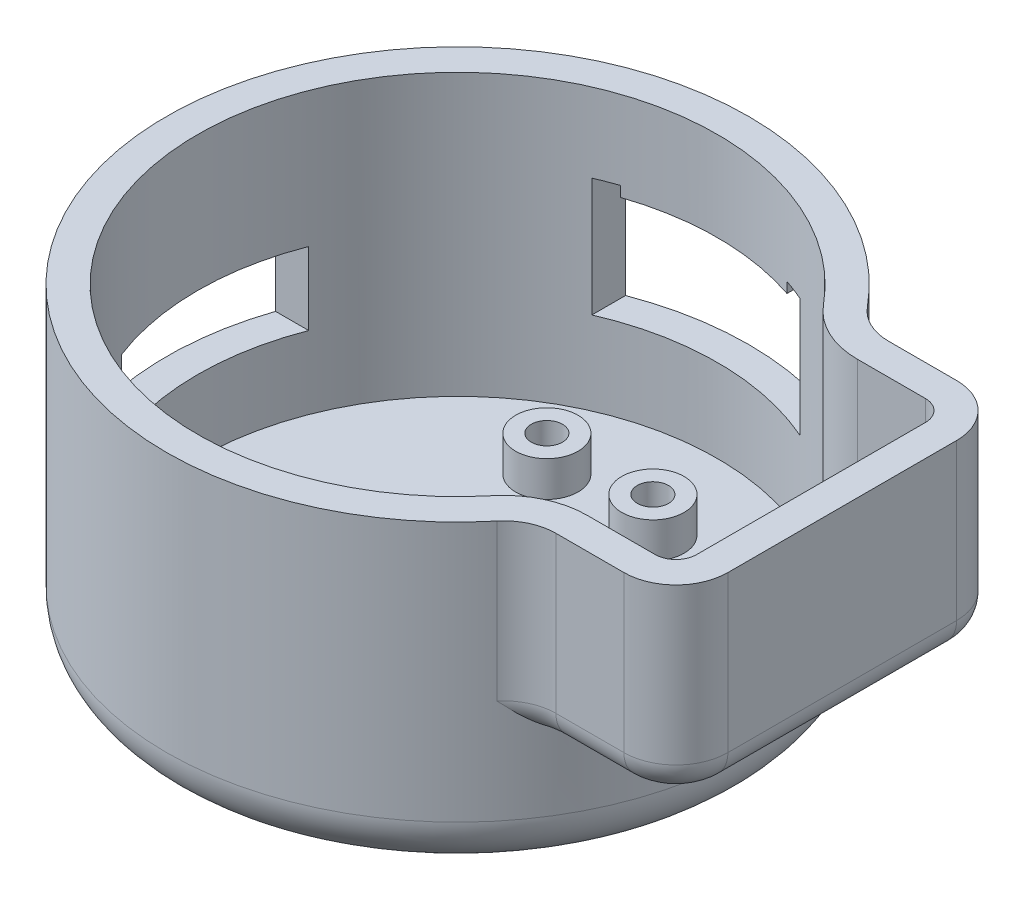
SolidWorks part; units mm, degrees
ref_plane "前视基准面" through (0, 0, 0) normal (0, 0, 1) x (1, 0, 0)
ref_plane "上视基准面" through (0, 0, 0) normal (0, 1, 0) x (1, 0, 0)
ref_plane "右视基准面" through (0, 0, 0) normal (1, 0, 0) x (0, 0, -1)
sketch "草图7" plane through (0, 0, 0) normal (0, 1, 0) x (1, 0, 0)
  circle A0 centre (0, 0) radius 14
  dimension "D1" = 28
extrude "凸台-拉伸2" add sketch "草图7" along normal blind 15
sketch "草图8" plane through (0, 15, 0) normal (0, 1, 0) x (1, 0, 0)
  line L1 (9.5, 8) -> (18.5, 8)
  line L2 (9.5, 8) -> (9.5, -8)
  line L3 (9.5, -8) -> (18.5, -8)
  line L4 (18.5, 8) -> (18.5, -8)
  line L5 (9.5, 8) -> (18.5, -8) construction
  line L6 (9.5, -8) -> (18.5, 8) construction
  circle A0 centre (0, 0) radius 14 construction
  point P0 (14, 0)
  dimension "D1" = 16
  dimension "D2" = 4.5
extrude "凸台-拉伸3" add sketch "草图8" against normal blind 9
fillet "圆角2" radius 2.5 2 edges at (11.4891, 10.5, 8) (11.4891, 10.5, -8)
fillet "圆角3" radius 2.5 2 edges at (18.5, 10.5, 8) (18.5, 10.5, -8)
shell "抽壳2" thickness 1.5
sketch "草图10" plane through (0, 1.5, 0) normal (0, 1, 0) x (1, 0, 0)
  line L1 (-3, 3) -> (3, 3)
  line L2 (-3, 3) -> (-3, -3)
  line L3 (-3, -3) -> (3, -3)
  line L4 (3, 3) -> (3, -3)
  line L5 (-3, 3) -> (3, -3) construction
  line L6 (-3, -3) -> (3, 3) construction
  point P0 (0, 0)
  dimension "D1" = 6
  dimension "D2" = 6
extrude "切除-拉伸6" cut sketch "草图10" against normal blind 0.2
sketch "草图11" plane through (0, 0, 0) normal (0, 0, 1) x (1, 0, 0)
  line L1 (-4, 10.7) -> (4, 10.7)
  line L2 (-5, 10.7) -> (-5, 5.5)
  line L3 (-5, 5.5) -> (5, 5.5)
  line L4 (5, 10.7) -> (5, 5.5)
  line L5 (-5, 10.7) -> (5, 5.5) construction
  line L6 (-5, 5.5) -> (5, 10.7) construction
  line L7 (12.7279, 7.5) -> (9.6424, 7.5) construction
  line L9 (-5, 10.7) -> (-5, 11.2)
  line L10 (-4, 10.7) -> (-4, 11.2)
  line L11 (-5, 11.2) -> (-4, 11.2)
  line L13 (5, 10.7) -> (5, 11.2)
  line L14 (4, 10.7) -> (4, 11.2)
  line L15 (5, 11.2) -> (4, 11.2)
  point P0 (0, 8.1)
  point P5 (0, 0)
  point P13 (0, 0)
  point P16 (0, 0)
  dimension "D1" = 10
  dimension "D2" = 5.2
  dimension "D3" = 2
  dimension "D4" = 0.5
  dimension "D5" = 1
  dimension "D6" = 1
  dimension "D7" = 0.5
  dimension "D8" = 5.2
extrude "切除-拉伸7" cut sketch "草图11" against normal blind 22.5
sketch "草图12" plane through (0, 0, 0) normal (1, 0, 0) x (0, 0, -1)
  line L0 (12.5, 1.5) -> (-12.5, 1.5) construction
  line L5 (-4.5, 8.5) -> (4.5, 8.5)
  line L6 (-4.5, 8.5) -> (-4.5, 5)
  line L13 (4.5, 8.5) -> (4.5, 5)
  line L15 (-4.5, 8.5) -> (4.5, 5) construction
  line L16 (-4.5, 5) -> (4.5, 8.5) construction
  line L17 (-5.5, 5) -> (-4.5, 5) construction
  line L18 (-5.5, 5) -> (-5.5, 3.5) construction
  line L19 (-5.5, 3.5) -> (5.5, 3.5) construction
  line L20 (5.5, 5) -> (5.5, 3.5) construction
  line L21 (-5.5, 5) -> (5.5, 3.5) construction
  line L22 (-5.5, 3.5) -> (5.5, 5) construction
  line L23 (4.5, 5) -> (5.5, 5) construction
  line L24 (-4.5, 5) -> (4.5, 5)
  point P0 (0, 6.75)
  point P5 (0, 4.25)
  dimension "D1" = 1.5
  dimension "D2" = 11
  dimension "D3" = 3.5
  dimension "D4" = 9
  dimension "D5" = 2
extrude "切除-拉伸8" cut sketch "草图12" against normal blind 22.5
sketch "草图13" plane through (0, 1.5, 0) normal (0, 1, 0) x (1, 0, 0)
  line L0 (-1000, 0) -> (49000, 0) construction
  circle A0 centre (-3.4565, 7.75) radius 0.75
  circle A1 centre (-3.4565, -7.75) radius 0.75
  circle A2 centre (-3.4565, 7.75) radius 1.5
  circle A3 centre (-3.4565, -7.75) radius 1.5
  circle A4 centre (1.5435, -7.75) radius 0.75
  circle A5 centre (1.5435, -7.75) radius 1.5
  circle A6 centre (1.6435, 7.75) radius 0.75
  circle A7 centre (1.6435, 7.75) radius 1.5
  point P10 (-13.9565, 0)
  dimension "D2" = 1.5
  dimension "D3" = 3
  dimension "D1" = 15.5
  dimension "D4" = 10.5
  dimension "D5" = 5
extrude "凸台-拉伸4" add sketch "草图13" along normal blind 1.7
fillet "圆角4" radius 2.5 1 edges at (0, 0, 14)
fillet "圆角5" radius 1.5 7 edges at (11.6619, 6, 8.2387) (14.364, 6, 8) (17.7678, 6, 7.2678) (18.5, 6, 0) (17.7678, 6, -7.2678) (14.364, 6, -8) (11.6619, 6, -8.2387)
sketch "草图14" plane through (0, 0, 0) normal (0, -1, 0) x (-1, 0, 0)
  line L0 (0, -1000) -> (0, 49000) construction
  line L1 (-2.0343, 10.2271) -> (1.2848, 7.7242) construction
  line L2 (1.2848, 7.7242) -> (-1.9224, 5.8331) construction
  line L3 (-1.9224, 5.8331) -> (1.7278, 3.3894) construction
  line L4 (1.7278, 3.3894) -> (-2.1428, 1.654) construction
  line L5 (-2.1428, 1.654) -> (8.4035, -2.3629) construction
  line L6 (8.4035, -2.3629) -> (-6.2386, -5.4504) construction
  line L7 (-6.2386, -5.4504) -> (-1.8354, -7.1275) construction
  line L8 (-1.8354, -7.1275) -> (-4.2923, -8.2291) construction
  line L9 (-4.2923, -8.2291) -> (-2.3348, -9.3983) construction
  line L10 (-2.3348, -9.3983) -> (-4.3509, -10.5227) construction
  line L11 (-2.3353, 9.8279) -> (0.3868, 7.7751)
  line L12 (0.3868, 7.7751) -> (-2.8613, 5.86)
  line L13 (-2.8613, 5.86) -> (0.6993, 3.4762)
  line L14 (0.6993, 3.4762) -> (-3.4489, 1.6164)
  line L15 (-3.4489, 1.6164) -> (6.6358, -2.2246)
  line L16 (6.6358, -2.2246) -> (-8.0063, -5.3122)
  line L17 (-8.0063, -5.3122) -> (-3.1414, -7.1651)
  line L18 (-3.1414, -7.1651) -> (-5.3733, -8.1658)
  line L19 (-5.3733, -8.1658) -> (-3.3347, -9.3835)
  line L20 (-3.3347, -9.3835) -> (-3.4035, -9.4219)
  line L21 (-1.7332, 10.6263) -> (2.1828, 7.6732)
  line L22 (2.1828, 7.6732) -> (-0.9835, 5.8063)
  line L23 (-0.9835, 5.8063) -> (2.7563, 3.3026)
  line L24 (2.7563, 3.3026) -> (-0.8368, 1.6916)
  line L25 (-0.8368, 1.6916) -> (10.1712, -2.5011)
  line L26 (10.1712, -2.5011) -> (-4.4709, -5.5887)
  line L27 (-4.4709, -5.5887) -> (-0.5294, -7.0899)
  line L28 (-0.5294, -7.0899) -> (-3.2113, -8.2924)
  line L29 (-3.2113, -8.2924) -> (-1.3349, -9.4132)
  line L30 (-1.3349, -9.4132) -> (-2.9165, -10.2952)
  line L31 (-2.3353, 9.8279) -> (-2.3353, 11.0803)
  line L32 (-1.7332, 10.6263) -> (-2.3353, 11.0803)
  line L34 (-2.9165, -10.2952) -> (-3.4035, -10.5669)
  line L35 (-2.3348, -9.3983) -> (-3.16, -9.8586) construction
  line L36 (-2.5783, -8.9616) -> (-3.8153, -9.6515) construction
  line L37 (-2.0912, -9.835) -> (-4.1073, -10.9594) construction
  line L38 (-3.4035, -9.4219) -> (-3.8153, -9.6515)
  line L39 (-3.4035, -10.5669) -> (-3.8153, -10.7966)
  line L40 (-3.8153, -10.7966) -> (-3.8153, -9.6515)
  line L41 (-4.0706, -9.7939) -> (-4.5944, -10.0861) construction
  line L42 (-2.5783, -8.9616) -> (-4.5944, -10.0861) construction
  dimension "D3" = 60
  dimension "D4" = 125
  dimension "D7" = 45
  dimension "D1" = 0.5
  dimension "D2" = 0.5
  dimension "D5" = 0.5
  dimension "D6" = 0.5
extrude "切除-拉伸9" cut sketch "草图14" against normal blind 0.5
